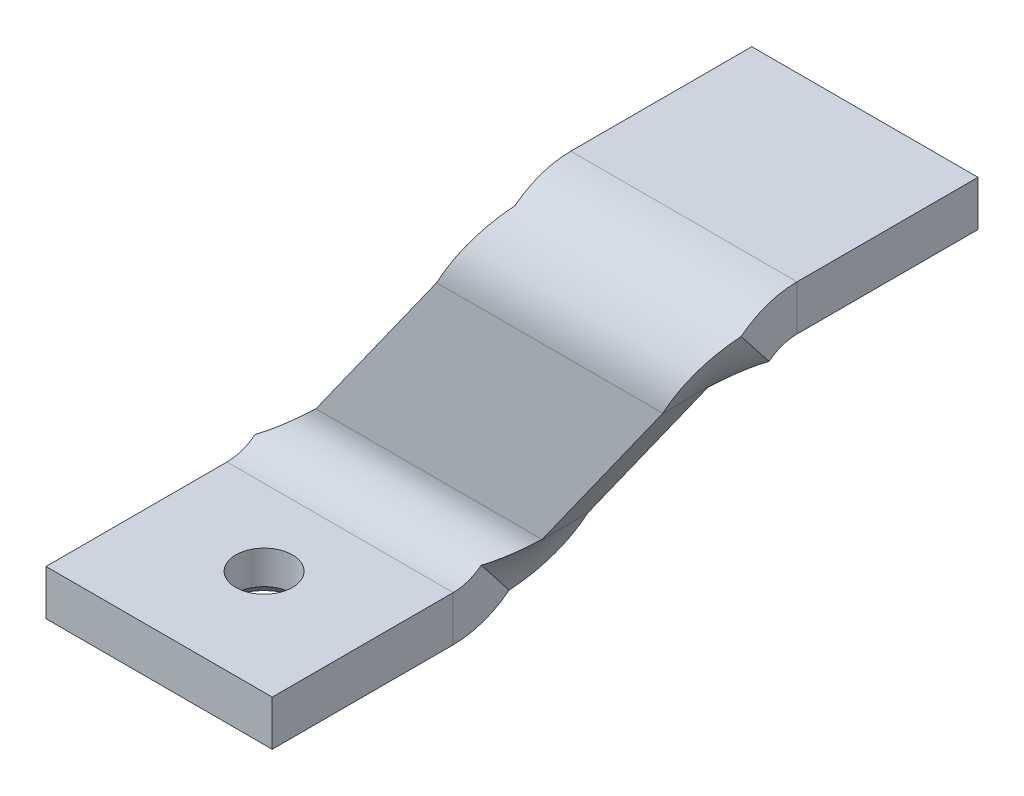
SolidWorks part; units mm, degrees
ref_plane "Přední rovina" through (0, 0, 0) normal (0, 0, 1) x (1, 0, 0)
ref_plane "Horní rovina" through (0, 0, 0) normal (0, 1, 0) x (1, 0, 0)
ref_plane "Pravá rovina" through (0, 0, 0) normal (1, 0, 0) x (0, 0, -1)
sketch "Skica12" plane through (0, 0, 0) normal (0, 0, 1) x (1, 0, 0)
  line L0 (-9.1962, 15.8258) -> (0.8038, 15.8258)
  line L1 (0.8038, 15.8258) -> (0.8038, 5.8258)
  line L2 (0.8038, 5.8258) -> (10, -7.0942)
  line L3 (10, -7.0942) -> (10, -17.0942)
  line L5 (10, -17.0942) -> (0, -17.0942)
  line L6 (0, -17.0942) -> (0, -7.0942)
  line L7 (0, -7.0942) -> (-9.1962, 5.8258)
  line L8 (-9.1962, 5.8258) -> (-9.1962, 15.8258)
  dimension "D1" = 10
  dimension "D2" = 10
  dimension "D3" = 10
  dimension "D4" = 10
  dimension "D5" = 10
  dimension "D6" = 10
  dimension "D7" = 12.92
  dimension "D8" = 19.1962
sheet metal parameters "Plechový díl2" thickness 2 parameters "D1"=2
base flange "Základní plech2" sketch "Skica12" thickness 2 reverse thickness direction no parameters "D1"=2
sketch "Skica16" plane through (0, 0, 0) normal (0, 0, 1) x (1, 0, 0)
  line L0 (0.8038, 5.8258) -> (-9.1962, 5.8258)
  line L1 (-9.1962, 5.8258) -> (0, -7.0942) construction
sketched bend "Ohyb ze skici1" parameters "D1"=2
bend "Ohyb ze skici2" bend radius 2 bend angle 90 parameters "D5"=1
sketch "Skica17" plane through (0, 5.8258, 0) normal (0, 1, 0) x (1, 0, 0)
  line L0 (0, 14.2076) -> (10, 14.2076)
sketched bend "Ohyb ze skici6" parameters "D1"=2
bend "Ohyb ze skici7" bend radius 2 bend angle 90 parameters "D5"=2
sketch "Skica18" plane through (0, -9.6694, 0) normal (0, -1, 0) x (1, 0, 0)
  line L0 (-4.1962, -2.2076) -> (-4.1962, -10.2076) construction
  line L1 (0.8038, -2.2076) -> (-9.1962, -2.2076) construction
  line L2 (0.8038, -10.2076) -> (-9.1962, -10.2076) construction
  line L3 (0.8038, -6.2076) -> (-9.1962, -7.4883) construction
  line L4 (0.8038, -10.2076) -> (0.8038, -2.2076) construction
  line L5 (-9.1962, -2.2076) -> (-9.1962, -10.2076) construction
  point P13 (-4.1962, -6.848)
hole_wizard "M3 závit2" positions "3DSkica2" profile "Skica19" tap size "M3" standard "ISO"
sketch3d "3DSkica2"
  point P0 (-4.1962, -9.6694, -6.848)
sketch "Skica19" plane through (-4.1962, -9.6694, -6.848) normal (1, 0, 0) x (0, 0, -1)
  line L0 (0, 0) -> (0, 16.2511)
  line L1 (0, 16.2511) -> (1.25, 15.5)
  line L2 (1.25, 15.5) -> (1.25, 0.525)
  line L3 (1.25, 0.525) -> (1.775, 0)
  line L5 (1.775, 0) -> (0, 0)
  line L6 (-1.25, 0.525) -> (-1.775, 0) construction
  line L10 (0, 16.2511) -> (-1.25, 15.5) construction
  line L11 (0, -6.35) -> (0, 107.95) construction
  dimension "Průměr závitníku" = 2.5
  dimension "Hloubka závitníku" = 15.5
  dimension "Průměr blíz. kuž. zahloubení" = 3.55
  dimension "Úhel blíz. kuž. zahloubení" = 90
  dimension "Úhel vrtání" = 118
flat pattern "Rozvinutý tvar2"
sketch "Čáry ohybu2" plane through (0, -9.6694, 0) normal (0, -1, 0) x (-1, 0, 0)
  line L0 (0.2535, 24.7714) -> (-9.7465, 24.7714) construction
  line L1 (8.9427, 12.5638) -> (-1.0573, 12.5638) construction
  line L2 (0.2535, 24.7714) -> (-9.7465, 24.7714) construction
  line L3 (8.9427, 12.5638) -> (-1.0573, 12.5638) construction
sketch3d "Vymezovací rámeček2" [suppressed]
  line L0 (-1.3866, 20.5502, 0) -> (12.6522, -14.4392, 0) construction
  line L1 (-13.456, 15.7076, 0) -> (0.5829, -19.2817, 0) construction
  line L2 (-1.3866, 20.5502, 0) -> (-13.456, 15.7076, 0) construction
  line L3 (12.6522, -14.4392, 0) -> (0.5829, -19.2817, 0) construction
bend of the flat pattern "Rozvinutí-<Ohyb ze skici2>1"
bend of the flat pattern "Rozvinutí-<Ohyb ze skici7>1"
